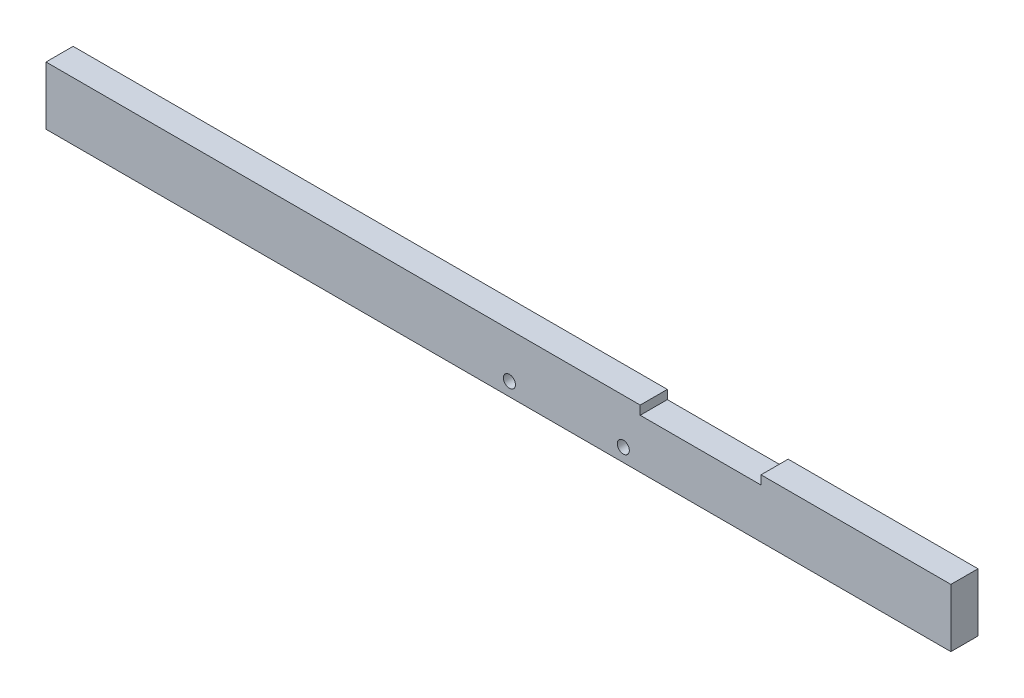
SolidWorks part; units mm, degrees
ref_plane "前视基准面" through (0, 0, 0) normal (0, 0, 1) x (1, 0, 0)
ref_plane "上视基准面" through (0, 0, 0) normal (0, 1, 0) x (1, 0, 0)
ref_plane "右视基准面" through (0, 0, 0) normal (1, 0, 0) x (0, 0, -1)
sketch "草图1" plane through (0, 0, 0) normal (0, 0, 1) x (1, 0, 0)
  line L0 (0, 0) -> (0, 21.7)
  line L1 (337, 0) -> (337, 21.7)
  line L2 (0, 0) -> (337, 0)
  line L3 (221.3, 18.4) -> (266.3, 18.4)
  line L4 (0, 21.7) -> (221.3, 21.7)
  line L5 (221.3, 18.4) -> (221.3, 21.7)
  line L6 (266.3, 18.4) -> (266.3, 21.7)
  line L7 (266.3, 21.7) -> (337, 21.7)
  circle A0 centre (215, 5) radius 2.25
  circle A1 centre (172.6, 5) radius 2.25
extrude "凸台-拉伸1" add sketch "草图1" along normal blind 10.1
